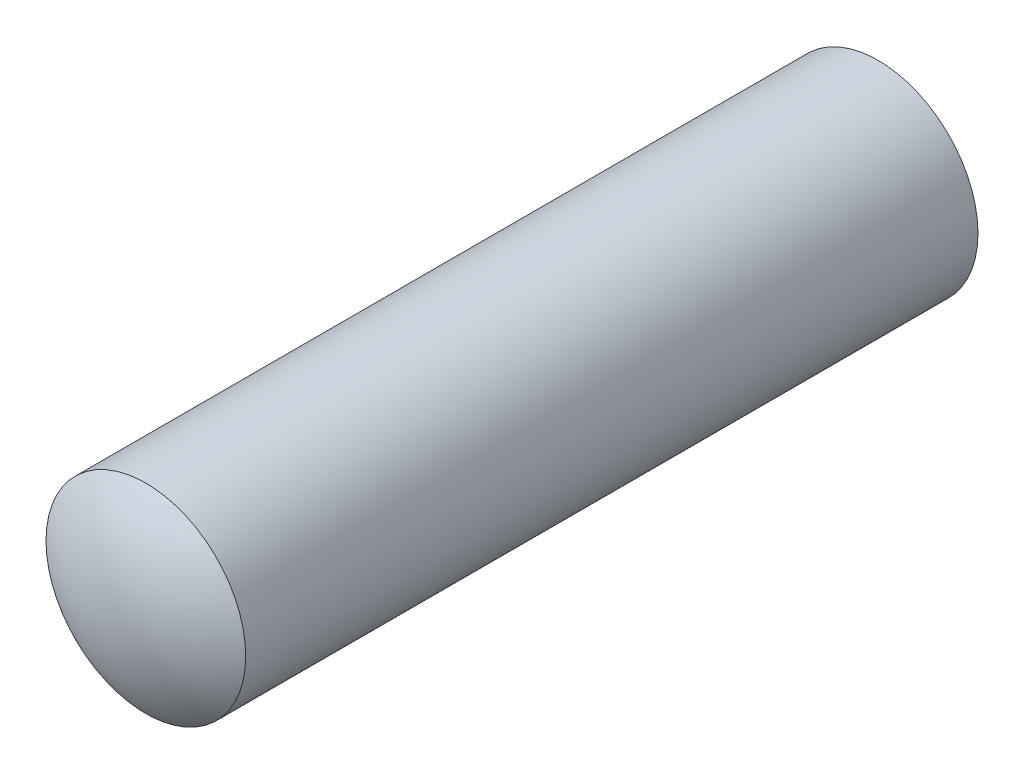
SolidWorks part; units mm, degrees
ref_plane "Face" through (0, 0, 0) normal (0, 0, 1) x (1, 0, 0)
ref_plane "Dessus" through (0, 0, 0) normal (0, 1, 0) x (1, 0, 0)
ref_plane "Droite" through (0, 0, 0) normal (1, 0, 0) x (0, 0, -1)
sketch "Esquisse1" plane through (0, 0, 0) normal (0, 0, 1) x (1, 0, 0)
  circle A0 centre (0, 0) radius 1.5
  dimension "D1" = 3
extrude "Extrusion2" add sketch "Esquisse1" along normal blind 11
dome "Dôme2" faces to dome 1 distance 0.5 parameters "D1"=0.5
dome "Dôme3" faces to dome 1 distance 0.5 parameters "D1"=0.5
